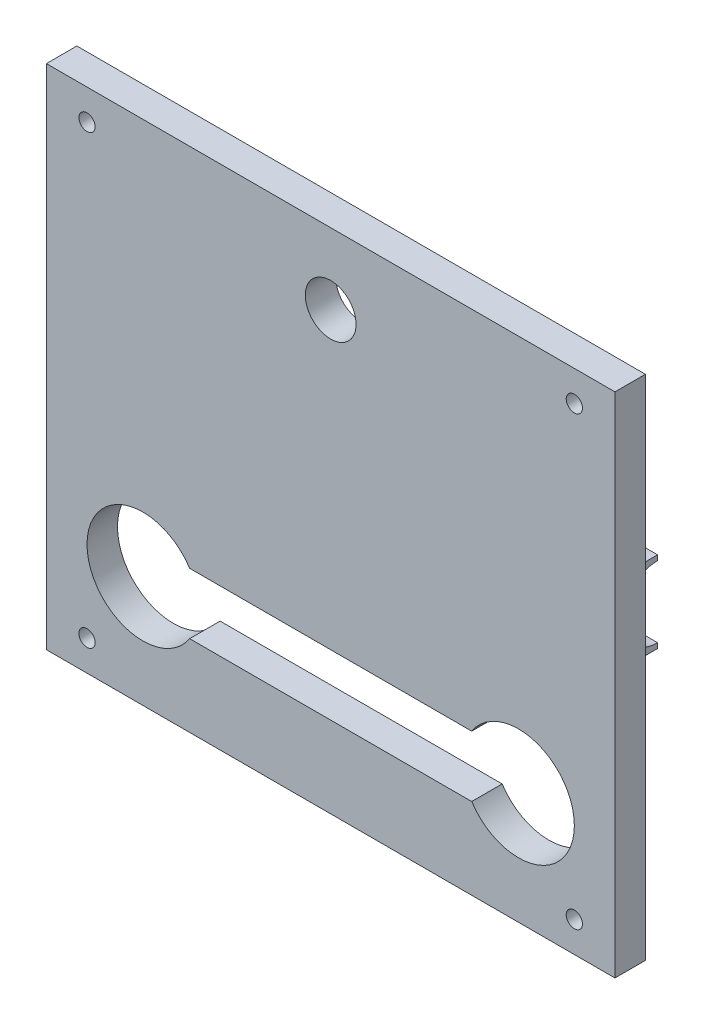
SolidWorks part; units mm, degrees
ref_plane "Plan de face" through (0, 0, 0) normal (0, 0, 1) x (1, 0, 0)
ref_plane "Plan de dessus" through (0, 0, 0) normal (0, 1, 0) x (1, 0, 0)
ref_plane "Plan de droite" through (0, 0, 0) normal (1, 0, 0) x (0, 0, -1)
sketch "Esquisse1" plane through (0, 0, 0) normal (0, 0, 1) x (1, 0, 0)
  line L1 (0, 0) -> (280, 0)
  line L2 (0, 0) -> (0, -250)
  line L3 (0, -250) -> (280, -250)
  line L4 (280, 0) -> (280, -250)
  dimension "D1" = 280
  dimension "D2" = 250
extrude "Boss.-Extru.1" add sketch "Esquisse1" along normal blind 15
sketch "Esquisse2" plane through (0, 0, 15) normal (0, 0, 1) x (1, 0, 0)
  line L0 (0, 0) -> (0, -250) construction
  line L1 (70.5489, -180) -> (209.4511, -180)
  line L2 (75, -195) -> (205, -195) construction
  line L3 (0, -250) -> (280, -250) construction
  line L4 (70.5489, -210) -> (209.4511, -210) construction
  line L5 (70.5489, -180) -> (209.4511, -180) construction
  line L6 (70.5489, -210) -> (209.4511, -210)
  line L7 (75, -180) -> (205, -180) construction
  line L8 (75, -210) -> (205, -210) construction
  circle A0 centre (47.5, -195) radius 17.5 construction
  circle A1 centre (232.5, -195) radius 17.5 construction
  arc A2 (70.5489, -180) -> (70.5489, -210) centre (47.5, -195) ccw
  arc A3 (209.4511, -210) -> (209.4511, -180) centre (232.5, -195) ccw
  circle A5 centre (47.5, -195) radius 27.5 construction
  circle A6 centre (232.5, -195) radius 27.5 construction
  point P10 (258.7984, -156.9598)
  point P12 (207.6813, -152.5)
  point P17 (208.0051, -152.5)
  point P18 (73.7984, -156.9598)
  point P21 (140, -180)
  point P24 (140, -210)
  point P29 (208.0051, -152.5)
  point P30 (207.6212, -177.5)
  dimension "D2" = 35
  dimension "D1" = 185
  dimension "D3" = 47.5
  dimension "D4" = 55
  dimension "D6" = 15
  dimension "D5" = 10
  dimension "D7" = 15
extrude "Enlèv. mat.-Extru.1" cut sketch "Esquisse2" against normal blind 15
sketch "Esquisse3" plane through (0, 0, 0) normal (0, 0, -1) x (-1, 0, 0)
  line L0 (-280, 0) -> (0, 0) construction
  line L1 (-255, -145) -> (-25, -145)
  line L2 (-255, -145) -> (-255, -105)
  line L3 (-255, -105) -> (-25, -105)
  line L4 (-25, -145) -> (-25, -105)
  line L6 (0, 0) -> (0, -250) construction
  line L7 (-280, -250) -> (-280, 0) construction
  point P4 (-255, -125)
  dimension "D1" = 40
  dimension "D2" = 125
  dimension "D3" = 25
  dimension "D4" = 25
extrude "Boss.-Extru.2" add sketch "Esquisse3" along normal blind 46 from surface at -15
sketch "Esquisse4" plane through (0, 0, 15) normal (0, 0, 1) x (1, 0, 0)
  line L1 (280, -250) -> (280, 0) construction
  line L2 (280, 0) -> (0, 0) construction
  circle A0 centre (140, -35) radius 12.5
  dimension "D2" = 25
  dimension "D1" = 140
  dimension "D3" = 35
extrude "Enlèv. mat.-Extru.2" cut sketch "Esquisse4" against normal blind 15
sketch "Esquisse5" plane through (0, 0, 15) normal (0, 0, 1) x (1, 0, 0)
  line L0 (0, -250) -> (280, -250) construction
  line L1 (0, 0) -> (0, -250) construction
  line L2 (280, -250) -> (280, 0) construction
  line L3 (280, 0) -> (0, 0) construction
  circle A0 centre (20, -235) radius 4
  circle A1 centre (260, -235) radius 4
  circle A2 centre (20, -15) radius 4
  circle A3 centre (260, -15) radius 4
  point P14 (0, 0)
  point P15 (0, 0)
  point P16 (0, 0)
  point P17 (0, 0)
  point P18 (20, -12.5611)
  dimension "D1" = 8
  dimension "D2" = 15
  dimension "D3" = 20
  dimension "D4" = 20
  dimension "D5" = 15
  dimension "D6" = 15
extrude "Enlèv. mat.-Extru.3" cut sketch "Esquisse5" against normal blind 15
sketch "Esquisse6" plane through (255, 0, 0) normal (1, 0, 0) x (0, 0, -1)
  line L0 (31, -105) -> (31, -145) construction
  line L1 (31, -142.5) -> (31, -107.5)
  arc A0 (31, -142.5) -> (31, -107.5) centre (31, -125) cw
  dimension "D1" = 17.5
extrude "Enlèv. mat.-Extru.4" cut sketch "Esquisse6" against normal through all
